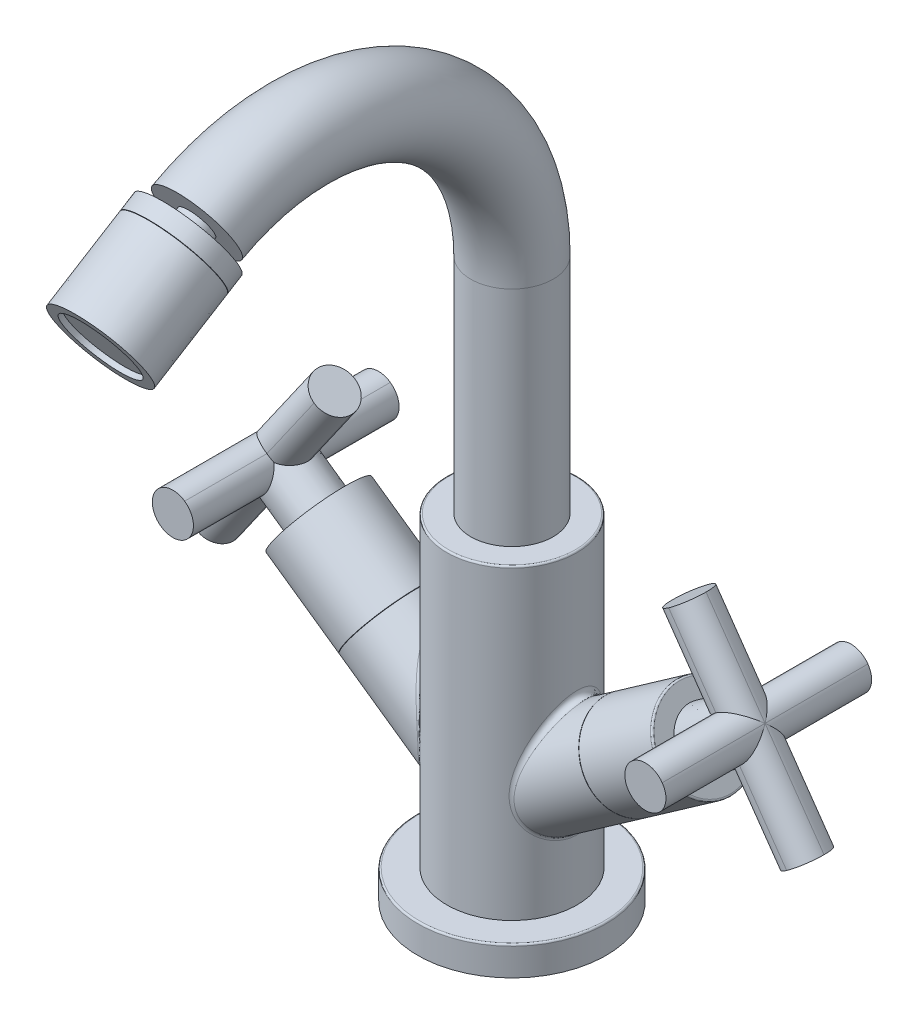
SolidWorks part; units mm, degrees
ref_plane "Front Plane" through (0, 0, 0) normal (0, 0, 1) x (1, 0, 0)
ref_plane "Top Plane" through (0, 0, 0) normal (0, 1, 0) x (1, 0, 0)
ref_plane "Right Plane" through (0, 0, 0) normal (1, 0, 0) x (0, 0, -1)
sketch "Sketch1" plane through (0, 0, 0) normal (0, 0, 1) x (1, 0, 0)
  line L0 (14, 200) -> (14, 213.1353)
  line L1 (-14, 213.1353) -> (-14, 200)
  line L2 (14, 213.1879) -> (14, 215.7624)
  line L3 (-14, 215.7624) -> (-14, 213.1879)
  line L4 (12, 163.0662) -> (12, 193.8645)
  line L5 (12, 221.898) -> (12, 225)
  line L6 (-12, 225) -> (-12, 221.898)
  line L7 (-12, 193.8645) -> (-12, 163.0662)
  line L8 (27.5, 0) -> (27.5, 8.5)
  line L9 (-27.5, 8.5) -> (-27.5, 0)
  line L10 (19, 65.0251) -> (19, 82.9)
  line L11 (19, 8.5) -> (19, 26.0343)
  line L12 (-19, 26.0343) -> (-19, 8.5)
  line L13 (-19, 82.9) -> (-19, 65.0251)
  line L14 (19, 83) -> (19, 98)
  line L15 (-19, 98) -> (-19, 83)
  line L16 (18, 82.9) -> (18, 83)
  line L17 (-18, 83) -> (-18, 82.9)
  line L18 (-42.6502, 43.5615) -> (-19.8331, 27.5848)
  line L19 (-22.1472, 63.3868) -> (-26.5901, 66.4978)
  line L20 (26.5901, 66.4978) -> (22.1472, 63.3868)
  line L21 (19.8331, 27.5848) -> (42.6502, 43.5615)
  line L22 (-64.0301, 58.5319) -> (-42.7321, 43.6189)
  line L23 (-26.672, 66.5551) -> (-47.9699, 81.4681)
  line L24 (47.9699, 81.4681) -> (26.672, 66.5551)
  line L25 (42.7321, 43.6189) -> (64.0301, 58.5319)
  line L26 (-42.1585, 44.438) -> (-42.0766, 44.3807)
  line L27 (-27.1636, 65.6786) -> (-27.2456, 65.736)
  line L28 (27.2456, 65.736) -> (27.1636, 65.6786)
  line L29 (42.0766, 44.3807) -> (42.1585, 44.438)
  line L30 (12, 98) -> (12, 163.0662)
  line L31 (-12, 163.0662) -> (-12, 98)
  line L34 (59.2319, 81.1747) -> (51.8129, 75.9798)
  line L35 (60.1871, 64.0202) -> (67.6062, 69.2151)
  line L36 (67.5327, 69.2207) -> (80.5797, 50.5876)
  line L37 (90.4095, 57.4706) -> (73.2022, 82.0451)
  line L38 (73.2022, 82.0451) -> (55.9949, 106.6197)
  line L39 (46.1651, 99.7368) -> (59.2121, 81.1037)
  line L40 (-67.6062, 69.2151) -> (-60.1871, 64.0202)
  line L41 (-51.8129, 75.9798) -> (-59.2319, 81.1747)
  line L42 (-73.2022, 82.0451) -> (-90.4095, 57.4706)
  line L43 (-80.5797, 50.5876) -> (-67.5327, 69.2207)
  line L44 (-59.2121, 81.1037) -> (-46.1651, 99.7368)
  line L45 (-55.9949, 106.6197) -> (-73.2022, 82.0451)
  line L48 (14, 213.1353) -> (13.9886, 213.615)
  line L49 (13.9886, 213.615) -> (13.7171, 215.518)
  line L50 (13.7171, 215.518) -> (13.0902, 217.3593)
  line L51 (13.0902, 217.3593) -> (12.1244, 219.0913)
  line L52 (12.1244, 219.0913) -> (10.8445, 220.6689)
  line L53 (10.8445, 220.6689) -> (9.2837, 222.0515)
  line L54 (9.2837, 222.0515) -> (7.4825, 223.2031)
  line L55 (7.4825, 223.2031) -> (5.4875, 224.094)
  line L56 (5.4875, 224.094) -> (3.3504, 224.7011)
  line L57 (3.3504, 224.7011) -> (1.1265, 225.0086)
  line L58 (1.1265, 225.0086) -> (-1.1265, 225.0086)
  line L59 (-1.1265, 225.0086) -> (-3.3504, 224.7011)
  line L60 (-3.3504, 224.7011) -> (-5.4875, 224.094)
  line L61 (-5.4875, 224.094) -> (-7.4825, 223.2031)
  line L62 (-7.4825, 223.2031) -> (-9.2837, 222.0515)
  line L63 (-9.2837, 222.0515) -> (-10.8445, 220.6689)
  line L64 (-10.8445, 220.6689) -> (-12.1244, 219.0913)
  line L65 (-12.1244, 219.0913) -> (-13.0902, 217.3593)
  line L66 (-13.0902, 217.3593) -> (-13.7171, 215.518)
  line L67 (-13.7171, 215.518) -> (-13.9886, 213.615)
  line L68 (-13.9886, 213.615) -> (-14, 213.1353)
  line L69 (-2.2458, 188.2424) -> (0, 188.0881)
  line L70 (0, 188.0881) -> (2.2458, 188.2424)
  line L71 (2.2458, 188.2424) -> (4.4334, 188.7012)
  line L72 (4.4334, 188.7012) -> (6.5061, 189.4526)
  line L73 (6.5061, 189.4526) -> (8.4104, 190.4772)
  line L74 (8.4104, 190.4772) -> (10.0968, 191.7484)
  line L75 (10.0968, 191.7484) -> (11.5218, 193.2333)
  line L76 (11.5218, 193.2333) -> (12.6483, 194.8935)
  line L77 (12.6483, 194.8935) -> (13.4473, 196.6859)
  line L78 (13.4473, 196.6859) -> (13.8979, 198.5642)
  line L79 (13.8979, 198.5642) -> (13.9886, 200.4796)
  line L80 (13.9886, 200.4796) -> (13.7171, 202.3827)
  line L81 (13.7171, 202.3827) -> (13.0902, 204.224)
  line L82 (13.0902, 204.224) -> (12.1244, 205.9559)
  line L83 (12.1244, 205.9559) -> (10.8445, 207.5336)
  line L84 (10.8445, 207.5336) -> (9.2837, 208.9162)
  line L85 (9.2837, 208.9162) -> (7.4825, 210.0678)
  line L86 (7.4825, 210.0678) -> (5.4875, 210.9587)
  line L87 (5.4875, 210.9587) -> (3.3504, 211.5657)
  line L88 (3.3504, 211.5657) -> (1.1265, 211.8732)
  line L89 (1.1265, 211.8732) -> (-1.1265, 211.8732)
  line L90 (-1.1265, 211.8732) -> (-3.3504, 211.5657)
  line L91 (-3.3504, 211.5657) -> (-5.4875, 210.9587)
  line L92 (-5.4875, 210.9587) -> (-7.4825, 210.0678)
  line L93 (-7.4825, 210.0678) -> (-9.2837, 208.9162)
  line L94 (-9.2837, 208.9162) -> (-10.8445, 207.5336)
  line L95 (-10.8445, 207.5336) -> (-12.1244, 205.9559)
  line L96 (-12.1244, 205.9559) -> (-13.0902, 204.224)
  line L97 (-13.0902, 204.224) -> (-13.7171, 202.3827)
  line L98 (-13.7171, 202.3827) -> (-13.9886, 200.4796)
  line L99 (-13.9886, 200.4796) -> (-13.8979, 198.5642)
  line L100 (-13.8979, 198.5642) -> (-13.4473, 196.6859)
  line L101 (-13.4473, 196.6859) -> (-12.6483, 194.8935)
  line L102 (-12.6483, 194.8935) -> (-11.5218, 193.2333)
  line L103 (-11.5218, 193.2333) -> (-10.0968, 191.7484)
  line L104 (-10.0968, 191.7484) -> (-8.4104, 190.4772)
  line L105 (-8.4104, 190.4772) -> (-6.5061, 189.4526)
  line L106 (-6.5061, 189.4526) -> (-4.4334, 188.7012)
  line L107 (-4.4334, 188.7012) -> (-2.2458, 188.2424)
  line L108 (1.9641, 190.7911) -> (0, 190.6407)
  line L109 (0, 190.6407) -> (-1.9641, 190.7911)
  line L110 (-1.9641, 190.7911) -> (-3.8651, 191.2375)
  line L111 (-3.8651, 191.2375) -> (-5.6419, 191.9655)
  line L112 (-5.6419, 191.9655) -> (-7.2373, 192.9518)
  line L113 (-7.2373, 192.9518) -> (-8.6001, 194.1646)
  line L114 (-8.6001, 194.1646) -> (-9.6866, 195.5649)
  line L115 (-9.6866, 195.5649) -> (-10.4616, 197.1078)
  line L116 (-10.4616, 197.1078) -> (-10.9004, 198.7437)
  line L117 (-10.9004, 198.7437) -> (-10.9889, 200.4199)
  line L118 (-10.9889, 200.4199) -> (-10.7242, 202.0827)
  line L119 (-10.7242, 202.0827) -> (-10.1148, 203.6785)
  line L120 (-10.1148, 203.6785) -> (-9.1803, 205.156)
  line L121 (-9.1803, 205.156) -> (-7.9507, 206.4679)
  line L122 (-7.9507, 206.4679) -> (-6.4656, 207.5719)
  line L123 (-6.4656, 207.5719) -> (-4.7727, 208.4325)
  line L124 (-4.7727, 208.4325) -> (-2.9264, 209.022)
  line L125 (-2.9264, 209.022) -> (-0.986, 209.3216)
  line L126 (-0.986, 209.3216) -> (0.986, 209.3216)
  line L127 (0.986, 209.3216) -> (2.9264, 209.022)
  line L128 (2.9264, 209.022) -> (4.7727, 208.4325)
  line L129 (4.7727, 208.4325) -> (6.4656, 207.5719)
  line L130 (6.4656, 207.5719) -> (7.9507, 206.4679)
  line L131 (7.9507, 206.4679) -> (9.1803, 205.156)
  line L132 (9.1803, 205.156) -> (10.1148, 203.6785)
  line L133 (10.1148, 203.6785) -> (10.7242, 202.0827)
  line L134 (10.7242, 202.0827) -> (10.9889, 200.4199)
  line L135 (10.9889, 200.4199) -> (10.9004, 198.7437)
  line L136 (10.9004, 198.7437) -> (10.4616, 197.1078)
  line L137 (10.4616, 197.1078) -> (9.6866, 195.5649)
  line L138 (9.6866, 195.5649) -> (8.6001, 194.1646)
  line L139 (8.6001, 194.1646) -> (7.2373, 192.9518)
  line L140 (7.2373, 192.9518) -> (5.6419, 191.9655)
  line L141 (5.6419, 191.9655) -> (3.8651, 191.2375)
  line L142 (3.8651, 191.2375) -> (1.9641, 190.7911)
  line L143 (-1.8925, 192.1707) -> (0, 192.017)
  line L144 (0, 192.017) -> (1.8925, 192.1707)
  line L145 (1.8925, 192.1707) -> (3.7166, 192.6264)
  line L146 (3.7166, 192.6264) -> (5.4064, 193.3676)
  line L147 (5.4064, 193.3676) -> (6.9008, 194.3676)
  line L148 (6.9008, 194.3676) -> (8.1458, 195.59)
  line L149 (8.1458, 195.59) -> (9.0963, 196.9909)
  line L150 (9.0963, 196.9909) -> (9.7181, 198.5195)
  line L151 (9.7181, 198.5195) -> (9.9887, 200.1206)
  line L152 (9.9887, 200.1206) -> (9.8982, 201.7363)
  line L153 (9.8982, 201.7363) -> (9.45, 203.3082)
  line L154 (9.45, 203.3082) -> (8.6603, 204.7796)
  line L155 (8.6603, 204.7796) -> (7.5575, 206.0973)
  line L156 (7.5575, 206.0973) -> (6.1816, 207.2135)
  line L157 (6.1816, 207.2135) -> (4.5823, 208.088)
  line L158 (4.5823, 208.088) -> (2.8173, 208.6892)
  line L159 (2.8173, 208.6892) -> (0.9506, 208.9954)
  line L160 (0.9506, 208.9954) -> (-0.9506, 208.9954)
  line L161 (-0.9506, 208.9954) -> (-2.8173, 208.6892)
  line L162 (-2.8173, 208.6892) -> (-4.5823, 208.088)
  line L163 (-4.5823, 208.088) -> (-6.1816, 207.2135)
  line L164 (-6.1816, 207.2135) -> (-7.5575, 206.0973)
  line L165 (-7.5575, 206.0973) -> (-8.6603, 204.7796)
  line L166 (-8.6603, 204.7796) -> (-9.45, 203.3082)
  line L167 (-9.45, 203.3082) -> (-9.8982, 201.7363)
  line L168 (-9.8982, 201.7363) -> (-9.9887, 200.1206)
  line L169 (-9.9887, 200.1206) -> (-9.7181, 198.5195)
  line L170 (-9.7181, 198.5195) -> (-9.0963, 196.9909)
  line L171 (-9.0963, 196.9909) -> (-8.1458, 195.59)
  line L172 (-8.1458, 195.59) -> (-6.9008, 194.3676)
  line L173 (-6.9008, 194.3676) -> (-5.4064, 193.3676)
  line L174 (-5.4064, 193.3676) -> (-3.7166, 192.6264)
  line L175 (-3.7166, 192.6264) -> (-1.8925, 192.1707)
  line L176 (0, 192.2797) -> (1.8925, 192.4334)
  line L177 (1.8925, 192.4334) -> (3.7166, 192.8891)
  line L178 (3.7166, 192.8891) -> (5.4064, 193.6303)
  line L179 (5.4064, 193.6303) -> (6.9008, 194.6303)
  line L180 (6.9008, 194.6303) -> (8.1458, 195.8527)
  line L181 (8.1458, 195.8527) -> (9.0963, 197.2536)
  line L182 (9.0963, 197.2536) -> (9.7181, 198.7822)
  line L183 (9.7181, 198.7822) -> (9.9887, 200.3833)
  line L184 (9.9887, 200.3833) -> (10, 200.7881)
  line L185 (-10, 200.7881) -> (-9.9887, 200.3833)
  line L186 (-9.9887, 200.3833) -> (-9.7181, 198.7822)
  line L187 (-9.7181, 198.7822) -> (-9.0963, 197.2536)
  line L188 (-9.0963, 197.2536) -> (-8.1458, 195.8527)
  line L189 (-8.1458, 195.8527) -> (-6.9008, 194.6303)
  line L190 (-6.9008, 194.6303) -> (-5.4064, 193.6303)
  line L191 (-5.4064, 193.6303) -> (-3.7166, 192.8891)
  line L192 (-3.7166, 192.8891) -> (-1.8925, 192.4334)
  line L193 (-1.8925, 192.4334) -> (0, 192.2797)
  line L194 (-2.3925, 207.9754) -> (-3.3925, 207.9754)
  line L195 (-3.3925, 207.9754) -> (-3.3925, 207.1246)
  line L196 (-3.3925, 207.1246) -> (-2.3925, 207.1246)
  line L197 (-2.3925, 207.1246) -> (-2.3925, 207.9754)
  line L198 (-1.4284, 205.7214) -> (-2.4284, 205.7214)
  line L199 (-2.4284, 205.7214) -> (-2.4284, 204.8706)
  line L200 (-2.4284, 204.8706) -> (-1.4284, 204.8706)
  line L201 (-1.4284, 204.8706) -> (-1.4284, 205.7214)
  line L202 (-3.3567, 205.1243) -> (-4.3567, 205.1243)
  line L203 (-4.3567, 205.1243) -> (-4.3567, 204.2734)
  line L204 (-4.3567, 204.2734) -> (-3.3567, 204.2734)
  line L205 (-3.3567, 204.2734) -> (-3.3567, 205.1243)
  line L206 (-6.8242, 204.8114) -> (-7.8242, 204.8114)
  line L207 (-7.8242, 204.8114) -> (-7.8242, 203.9606)
  line L208 (-7.8242, 203.9606) -> (-6.8242, 203.9606)
  line L209 (-6.8242, 203.9606) -> (-6.8242, 204.8114)
  line L210 (-4.3828, 203.6121) -> (-5.3828, 203.6121)
  line L211 (-5.3828, 203.6121) -> (-5.3828, 202.7613)
  line L212 (-5.3828, 202.7613) -> (-4.3828, 202.7613)
  line L213 (-4.3828, 202.7613) -> (-4.3828, 203.6121)
  line L214 (-5.4088, 202.1) -> (-6.4088, 202.1)
  line L215 (-6.4088, 202.1) -> (-6.4088, 201.2492)
  line L216 (-6.4088, 201.2492) -> (-5.4088, 201.2492)
  line L217 (-5.4088, 201.2492) -> (-5.4088, 202.1)
  line L218 (-7.8287, 199.964) -> (-8.8287, 199.964)
  line L219 (-8.8287, 199.964) -> (-8.8287, 199.1132)
  line L220 (-8.8287, 199.1132) -> (-7.8287, 199.1132)
  line L221 (-7.8287, 199.1132) -> (-7.8287, 199.964)
  line L222 (-5.0525, 200.3805) -> (-6.0525, 200.3805)
  line L223 (-6.0525, 200.3805) -> (-6.0525, 199.5297)
  line L224 (-6.0525, 199.5297) -> (-5.0525, 199.5297)
  line L225 (-5.0525, 199.5297) -> (-5.0525, 200.3805)
  line L226 (-4.6962, 198.661) -> (-5.6962, 198.661)
  line L227 (-5.6962, 198.661) -> (-5.6962, 197.8102)
  line L228 (-5.6962, 197.8102) -> (-4.6962, 197.8102)
  line L229 (-4.6962, 197.8102) -> (-4.6962, 198.661)
  line L230 (-4.9362, 195.7012) -> (-5.9362, 195.7012)
  line L231 (-5.9362, 195.7012) -> (-5.9362, 194.8504)
  line L232 (-5.9362, 194.8504) -> (-4.9362, 194.8504)
  line L233 (-4.9362, 194.8504) -> (-4.9362, 195.7012)
  line L234 (-3.1241, 197.5387) -> (-4.1241, 197.5387)
  line L235 (-4.1241, 197.5387) -> (-4.1241, 196.6878)
  line L236 (-4.1241, 196.6878) -> (-3.1241, 196.6878)
  line L237 (-3.1241, 196.6878) -> (-3.1241, 197.5387)
  line L238 (-1.5521, 196.4163) -> (-2.5521, 196.4163)
  line L239 (-2.5521, 196.4163) -> (-2.5521, 195.5655)
  line L240 (-2.5521, 195.5655) -> (-1.5521, 195.5655)
  line L241 (-1.5521, 195.5655) -> (-1.5521, 196.4163)
  line L242 (0.5, 194.0177) -> (-0.5, 194.0177)
  line L243 (-0.5, 194.0177) -> (-0.5, 193.1669)
  line L244 (-0.5, 193.1669) -> (0.5, 193.1669)
  line L245 (0.5, 193.1669) -> (0.5, 194.0177)
  line L246 (0.5, 196.4163) -> (-0.5, 196.4163)
  line L247 (-0.5, 196.4163) -> (-0.5, 195.5655)
  line L248 (-0.5, 195.5655) -> (0.5, 195.5655)
  line L249 (0.5, 195.5655) -> (0.5, 196.4163)
  line L250 (2.5521, 196.4163) -> (1.5521, 196.4163)
  line L251 (1.5521, 196.4163) -> (1.5521, 195.5655)
  line L252 (1.5521, 195.5655) -> (2.5521, 195.5655)
  line L253 (2.5521, 195.5655) -> (2.5521, 196.4163)
  line L254 (-1.4284, 203.1689) -> (-2.4284, 203.1689)
  line L255 (-2.4284, 203.1689) -> (-2.4284, 202.3181)
  line L256 (-2.4284, 202.3181) -> (-1.4284, 202.3181)
  line L257 (-1.4284, 202.3181) -> (-1.4284, 203.1689)
  line L258 (5.9362, 195.7012) -> (4.9362, 195.7012)
  line L259 (4.9362, 195.7012) -> (4.9362, 194.8504)
  line L260 (4.9362, 194.8504) -> (5.9362, 194.8504)
  line L261 (5.9362, 194.8504) -> (5.9362, 195.7012)
  line L262 (4.1241, 197.5387) -> (3.1241, 197.5387)
  line L263 (3.1241, 197.5387) -> (3.1241, 196.6878)
  line L264 (3.1241, 196.6878) -> (4.1241, 196.6878)
  line L265 (4.1241, 196.6878) -> (4.1241, 197.5387)
  line L266 (-2.4544, 201.6568) -> (-3.4544, 201.6568)
  line L267 (-3.4544, 201.6568) -> (-3.4544, 200.806)
  line L268 (-3.4544, 200.806) -> (-2.4544, 200.806)
  line L269 (-2.4544, 200.806) -> (-2.4544, 201.6568)
  line L270 (5.6962, 198.661) -> (4.6962, 198.661)
  line L271 (4.6962, 198.661) -> (4.6962, 197.8102)
  line L272 (4.6962, 197.8102) -> (5.6962, 197.8102)
  line L273 (5.6962, 197.8102) -> (5.6962, 198.661)
  line L274 (-2.0981, 199.9373) -> (-3.0981, 199.9373)
  line L275 (-3.0981, 199.9373) -> (-3.0981, 199.0864)
  line L276 (-3.0981, 199.0864) -> (-2.0981, 199.0864)
  line L277 (-2.0981, 199.0864) -> (-2.0981, 199.9373)
  line L278 (8.8287, 199.964) -> (7.8287, 199.964)
  line L279 (7.8287, 199.964) -> (7.8287, 199.1132)
  line L280 (7.8287, 199.1132) -> (8.8287, 199.1132)
  line L281 (8.8287, 199.1132) -> (8.8287, 199.964)
  line L282 (6.0525, 200.3805) -> (5.0525, 200.3805)
  line L283 (5.0525, 200.3805) -> (5.0525, 199.5297)
  line L284 (5.0525, 199.5297) -> (6.0525, 199.5297)
  line L285 (6.0525, 199.5297) -> (6.0525, 200.3805)
  line L286 (-0.5261, 198.815) -> (-1.5261, 198.815)
  line L287 (-1.5261, 198.815) -> (-1.5261, 197.9641)
  line L288 (-1.5261, 197.9641) -> (-0.5261, 197.9641)
  line L289 (-0.5261, 197.9641) -> (-0.5261, 198.815)
  line L290 (6.4088, 202.1) -> (5.4088, 202.1)
  line L291 (5.4088, 202.1) -> (5.4088, 201.2492)
  line L292 (5.4088, 201.2492) -> (6.4088, 201.2492)
  line L293 (6.4088, 201.2492) -> (6.4088, 202.1)
  line L294 (1.5261, 198.815) -> (0.5261, 198.815)
  line L295 (0.5261, 198.815) -> (0.5261, 197.9641)
  line L296 (0.5261, 197.9641) -> (1.5261, 197.9641)
  line L297 (1.5261, 197.9641) -> (1.5261, 198.815)
  line L298 (7.8242, 204.8114) -> (6.8242, 204.8114)
  line L299 (6.8242, 204.8114) -> (6.8242, 203.9606)
  line L300 (6.8242, 203.9606) -> (7.8242, 203.9606)
  line L301 (7.8242, 203.9606) -> (7.8242, 204.8114)
  line L302 (5.3828, 203.6121) -> (4.3828, 203.6121)
  line L303 (4.3828, 203.6121) -> (4.3828, 202.7613)
  line L304 (4.3828, 202.7613) -> (5.3828, 202.7613)
  line L305 (5.3828, 202.7613) -> (5.3828, 203.6121)
  line L306 (3.0981, 199.9373) -> (2.0981, 199.9373)
  line L307 (2.0981, 199.9373) -> (2.0981, 199.0864)
  line L308 (2.0981, 199.0864) -> (3.0981, 199.0864)
  line L309 (3.0981, 199.0864) -> (3.0981, 199.9373)
  line L310 (4.3567, 205.1243) -> (3.3567, 205.1243)
  line L311 (3.3567, 205.1243) -> (3.3567, 204.2734)
  line L312 (3.3567, 204.2734) -> (4.3567, 204.2734)
  line L313 (4.3567, 204.2734) -> (4.3567, 205.1243)
  line L314 (3.4544, 201.6568) -> (2.4544, 201.6568)
  line L315 (2.4544, 201.6568) -> (2.4544, 200.806)
  line L316 (2.4544, 200.806) -> (3.4544, 200.806)
  line L317 (3.4544, 200.806) -> (3.4544, 201.6568)
  line L318 (3.3925, 207.9754) -> (2.3925, 207.9754)
  line L319 (2.3925, 207.9754) -> (2.3925, 207.1246)
  line L320 (2.3925, 207.1246) -> (3.3925, 207.1246)
  line L321 (3.3925, 207.1246) -> (3.3925, 207.9754)
  line L322 (2.4284, 205.7214) -> (1.4284, 205.7214)
  line L323 (1.4284, 205.7214) -> (1.4284, 204.8706)
  line L324 (1.4284, 204.8706) -> (2.4284, 204.8706)
  line L325 (2.4284, 204.8706) -> (2.4284, 205.7214)
  line L326 (2.4284, 203.1689) -> (1.4284, 203.1689)
  line L327 (1.4284, 203.1689) -> (1.4284, 202.3181)
  line L328 (1.4284, 202.3181) -> (2.4284, 202.3181)
  line L329 (2.4284, 202.3181) -> (2.4284, 203.1689)
  line L330 (0.5, 206.3186) -> (-0.5, 206.3186)
  line L331 (-0.5, 206.3186) -> (-0.5, 205.4678)
  line L332 (-0.5, 205.4678) -> (0.5, 205.4678)
  line L333 (0.5, 205.4678) -> (0.5, 206.3186)
  line L334 (0.5, 201.2135) -> (-0.5, 201.2135)
  line L335 (-0.5, 201.2135) -> (-0.5, 200.3627)
  line L336 (-0.5, 200.3627) -> (0.5, 200.3627)
  line L337 (0.5, 200.3627) -> (0.5, 201.2135)
  line L338 (0.5, 203.7661) -> (-0.5, 203.7661)
  line L339 (-0.5, 203.7661) -> (-0.5, 202.9152)
  line L340 (-0.5, 202.9152) -> (0.5, 202.9152)
  line L341 (0.5, 202.9152) -> (0.5, 203.7661)
  line L342 (14, 213.1879) -> (13.9886, 213.6675)
  line L343 (13.9886, 213.6675) -> (13.7171, 215.5706)
  line L344 (13.7171, 215.5706) -> (13.0902, 217.4119)
  line L345 (13.0902, 217.4119) -> (12.1244, 219.1438)
  line L346 (12.1244, 219.1438) -> (10.8445, 220.7215)
  line L347 (10.8445, 220.7215) -> (9.2837, 222.104)
  line L348 (9.2837, 222.104) -> (7.4825, 223.2557)
  line L349 (7.4825, 223.2557) -> (5.4875, 224.1465)
  line L350 (5.4875, 224.1465) -> (3.3504, 224.7536)
  line L351 (3.3504, 224.7536) -> (1.1265, 225.0611)
  line L352 (1.1265, 225.0611) -> (-1.1265, 225.0611)
  line L353 (-1.1265, 225.0611) -> (-3.3504, 224.7536)
  line L354 (-3.3504, 224.7536) -> (-5.4875, 224.1465)
  line L355 (-5.4875, 224.1465) -> (-7.4825, 223.2557)
  line L356 (-7.4825, 223.2557) -> (-9.2837, 222.104)
  line L357 (-9.2837, 222.104) -> (-10.8445, 220.7215)
  line L358 (-10.8445, 220.7215) -> (-12.1244, 219.1438)
  line L359 (-12.1244, 219.1438) -> (-13.0902, 217.4119)
  line L360 (-13.0902, 217.4119) -> (-13.7171, 215.5706)
  line L361 (-13.7171, 215.5706) -> (-13.9886, 213.6675)
  line L362 (-13.9886, 213.6675) -> (-14, 213.1879)
  line L363 (14, 215.7624) -> (13.9886, 216.242)
  line L364 (13.9886, 216.242) -> (13.7171, 218.1451)
  line L365 (13.7171, 218.1451) -> (13.0902, 219.9864)
  line L366 (13.0902, 219.9864) -> (12.1244, 221.7183)
  line L367 (12.1244, 221.7183) -> (10.8445, 223.296)
  line L368 (10.8445, 223.296) -> (9.2837, 224.6786)
  line L369 (9.2837, 224.6786) -> (7.4825, 225.8302)
  line L370 (7.4825, 225.8302) -> (5.4875, 226.7211)
  line L371 (5.4875, 226.7211) -> (3.3504, 227.3281)
  line L372 (3.3504, 227.3281) -> (1.1265, 227.6356)
  line L373 (1.1265, 227.6356) -> (-1.1265, 227.6356)
  line L374 (-1.1265, 227.6356) -> (-3.3504, 227.3281)
  line L375 (-3.3504, 227.3281) -> (-5.4875, 226.7211)
  line L376 (-5.4875, 226.7211) -> (-7.4825, 225.8302)
  line L377 (-7.4825, 225.8302) -> (-9.2837, 224.6786)
  line L378 (-9.2837, 224.6786) -> (-10.8445, 223.296)
  line L379 (-10.8445, 223.296) -> (-12.1244, 221.7183)
  line L380 (-12.1244, 221.7183) -> (-13.0902, 219.9864)
  line L381 (-13.0902, 219.9864) -> (-13.7171, 218.1451)
  line L382 (-13.7171, 218.1451) -> (-13.9886, 216.242)
  line L383 (-13.9886, 216.242) -> (-14, 215.7624)
  line L384 (27.5, 0) -> (-27.5, 0)
  line L385 (27.5, 8.5) -> (-27.5, 8.5)
  line L386 (18.9131, 26.0477) -> (18.9265, 26.0343)
  line L387 (-18.9132, 26.0477) -> (-18.9265, 26.0343)
  line L388 (19, 82.9) -> (-19, 82.9)
  line L389 (19, 83) -> (-19, 83)
  line L390 (19, 98) -> (-19, 98)
  line L391 (-26.5901, 66.4978) -> (-26.694, 66.3493)
  line L392 (-26.694, 66.3493) -> (-27.0033, 65.9076)
  line L393 (-27.0033, 65.9076) -> (-27.5099, 65.1842)
  line L394 (-27.5099, 65.1842) -> (-28.2006, 64.1978)
  line L395 (-28.2006, 64.1978) -> (-29.0575, 62.9739)
  line L396 (-29.0575, 62.9739) -> (-30.0585, 61.5443)
  line L397 (-30.0585, 61.5443) -> (-31.1777, 59.946)
  line L398 (-31.1777, 59.946) -> (-32.386, 58.2203)
  line L399 (-32.386, 58.2203) -> (-33.6522, 56.412)
  line L400 (-33.6522, 56.412) -> (-34.9435, 54.5679)
  line L401 (-34.9435, 54.5679) -> (-36.2264, 52.7357)
  line L402 (-36.2264, 52.7357) -> (-37.4676, 50.963)
  line L403 (-37.4676, 50.963) -> (-38.6352, 49.2956)
  line L404 (-38.6352, 49.2956) -> (-39.6987, 47.7767)
  line L405 (-39.6987, 47.7767) -> (-40.6307, 46.4456)
  line L406 (-40.6307, 46.4456) -> (-41.4071, 45.3369)
  line L407 (-41.4071, 45.3369) -> (-42.0076, 44.4792)
  line L408 (-42.0076, 44.4792) -> (-42.4169, 43.8948)
  line L409 (-42.4169, 43.8948) -> (-42.6242, 43.5987)
  line L410 (-42.6242, 43.5987) -> (-42.6502, 43.5615)
  line L411 (26.5901, 66.4978) -> (26.694, 66.3493)
  line L412 (26.694, 66.3493) -> (27.0033, 65.9076)
  line L413 (27.0033, 65.9076) -> (27.5099, 65.1842)
  line L414 (27.5099, 65.1842) -> (28.2006, 64.1978)
  line L415 (28.2006, 64.1978) -> (29.0575, 62.9739)
  line L416 (29.0575, 62.9739) -> (30.0585, 61.5443)
  line L417 (30.0585, 61.5443) -> (31.1777, 59.946)
  line L418 (31.1777, 59.946) -> (32.386, 58.2203)
  line L419 (32.386, 58.2203) -> (33.6522, 56.412)
  line L420 (33.6522, 56.412) -> (34.9435, 54.5679)
  line L421 (34.9435, 54.5679) -> (36.2264, 52.7357)
  line L422 (36.2264, 52.7357) -> (37.4676, 50.963)
  line L423 (37.4676, 50.963) -> (38.6352, 49.2956)
  line L424 (38.6352, 49.2956) -> (39.6987, 47.7767)
  line L425 (39.6987, 47.7767) -> (40.6307, 46.4456)
  line L426 (40.6307, 46.4456) -> (41.4071, 45.3369)
  line L427 (41.4071, 45.3369) -> (42.0076, 44.4792)
  line L428 (42.0076, 44.4792) -> (42.4169, 43.8948)
  line L429 (42.4169, 43.8948) -> (42.6242, 43.5987)
  line L430 (42.6242, 43.5987) -> (42.6502, 43.5615)
  line L431 (-26.672, 66.5551) -> (-26.776, 66.4066)
  line L432 (-26.776, 66.4066) -> (-27.0852, 65.965)
  line L433 (-27.0852, 65.965) -> (-27.5918, 65.2415)
  line L434 (-27.5918, 65.2415) -> (-28.2825, 64.2551)
  line L435 (-28.2825, 64.2551) -> (-29.1394, 63.0313)
  line L436 (-29.1394, 63.0313) -> (-30.1404, 61.6017)
  line L437 (-30.1404, 61.6017) -> (-31.2596, 60.0033)
  line L438 (-31.2596, 60.0033) -> (-32.4679, 58.2776)
  line L439 (-32.4679, 58.2776) -> (-33.7341, 56.4693)
  line L440 (-33.7341, 56.4693) -> (-35.0254, 54.6252)
  line L441 (-35.0254, 54.6252) -> (-36.3083, 52.7931)
  line L442 (-36.3083, 52.7931) -> (-37.5495, 51.0204)
  line L443 (-37.5495, 51.0204) -> (-38.7171, 49.353)
  line L444 (-38.7171, 49.353) -> (-39.7806, 47.834)
  line L445 (-39.7806, 47.834) -> (-40.7126, 46.503)
  line L446 (-40.7126, 46.503) -> (-41.489, 45.3943)
  line L447 (-41.489, 45.3943) -> (-42.0895, 44.5366)
  line L448 (-42.0895, 44.5366) -> (-42.4988, 43.9521)
  line L449 (-42.4988, 43.9521) -> (-42.7061, 43.6561)
  line L450 (-42.7061, 43.6561) -> (-42.7321, 43.6189)
  line L451 (-47.9699, 81.4681) -> (-48.0739, 81.3196)
  line L452 (-48.0739, 81.3196) -> (-48.3832, 80.8779)
  line L453 (-48.3832, 80.8779) -> (-48.8897, 80.1545)
  line L454 (-48.8897, 80.1545) -> (-49.5804, 79.1681)
  line L455 (-49.5804, 79.1681) -> (-50.4374, 77.9443)
  line L456 (-50.4374, 77.9443) -> (-51.4384, 76.5146)
  line L457 (-51.4384, 76.5146) -> (-52.5576, 74.9163)
  line L458 (-52.5576, 74.9163) -> (-53.7659, 73.1906)
  line L459 (-53.7659, 73.1906) -> (-55.0321, 71.3823)
  line L460 (-55.0321, 71.3823) -> (-56.3233, 69.5382)
  line L461 (-56.3233, 69.5382) -> (-57.6062, 67.7061)
  line L462 (-57.6062, 67.7061) -> (-58.8475, 65.9334)
  line L463 (-58.8475, 65.9334) -> (-60.015, 64.2659)
  line L464 (-60.015, 64.2659) -> (-61.0786, 62.747)
  line L465 (-61.0786, 62.747) -> (-62.0106, 61.416)
  line L466 (-62.0106, 61.416) -> (-62.7869, 60.3073)
  line L467 (-62.7869, 60.3073) -> (-63.3875, 59.4496)
  line L468 (-63.3875, 59.4496) -> (-63.7967, 58.8651)
  line L469 (-63.7967, 58.8651) -> (-64.004, 58.5691)
  line L470 (-64.004, 58.5691) -> (-64.0301, 58.5319)
  line L471 (26.672, 66.5551) -> (26.776, 66.4066)
  line L472 (26.776, 66.4066) -> (27.0852, 65.965)
  line L473 (27.0852, 65.965) -> (27.5918, 65.2415)
  line L474 (27.5918, 65.2415) -> (28.2825, 64.2551)
  line L475 (28.2825, 64.2551) -> (29.1394, 63.0313)
  line L476 (29.1394, 63.0313) -> (30.1404, 61.6017)
  line L477 (30.1404, 61.6017) -> (31.2596, 60.0033)
  line L478 (31.2596, 60.0033) -> (32.4679, 58.2776)
  line L479 (32.4679, 58.2776) -> (33.7341, 56.4693)
  line L480 (33.7341, 56.4693) -> (35.0254, 54.6252)
  line L481 (35.0254, 54.6252) -> (36.3083, 52.7931)
  line L482 (36.3083, 52.7931) -> (37.5495, 51.0204)
  line L483 (37.5495, 51.0204) -> (38.7171, 49.353)
  line L484 (38.7171, 49.353) -> (39.7806, 47.834)
  line L485 (39.7806, 47.834) -> (40.7126, 46.503)
  line L486 (40.7126, 46.503) -> (41.489, 45.3943)
  line L487 (41.489, 45.3943) -> (42.0895, 44.5366)
  line L488 (42.0895, 44.5366) -> (42.4988, 43.9521)
  line L489 (42.4988, 43.9521) -> (42.7061, 43.6561)
  line L490 (42.7061, 43.6561) -> (42.7321, 43.6189)
  line L491 (47.9699, 81.4681) -> (48.0739, 81.3196)
  line L492 (48.0739, 81.3196) -> (48.3832, 80.8779)
  line L493 (48.3832, 80.8779) -> (48.8897, 80.1545)
  line L494 (48.8897, 80.1545) -> (49.5804, 79.1681)
  line L495 (49.5804, 79.1681) -> (50.4374, 77.9443)
  line L496 (50.4374, 77.9443) -> (51.4384, 76.5146)
  line L497 (51.4384, 76.5146) -> (52.5576, 74.9163)
  line L498 (52.5576, 74.9163) -> (53.7659, 73.1906)
  line L499 (53.7659, 73.1906) -> (55.0321, 71.3823)
  line L500 (55.0321, 71.3823) -> (56.3233, 69.5382)
  line L501 (56.3233, 69.5382) -> (57.6062, 67.7061)
  line L502 (57.6062, 67.7061) -> (58.8475, 65.9334)
  line L503 (58.8475, 65.9334) -> (60.015, 64.2659)
  line L504 (60.015, 64.2659) -> (61.0786, 62.747)
  line L505 (61.0786, 62.747) -> (62.0106, 61.416)
  line L506 (62.0106, 61.416) -> (62.7869, 60.3073)
  line L507 (62.7869, 60.3073) -> (63.3875, 59.4496)
  line L508 (63.3875, 59.4496) -> (63.7967, 58.8651)
  line L509 (63.7967, 58.8651) -> (64.004, 58.5691)
  line L510 (64.004, 58.5691) -> (64.0301, 58.5319)
  line L515 (90.4095, 57.4706) -> (90.3707, 57.4434)
  line L516 (90.3707, 57.4434) -> (90.0643, 57.2289)
  line L517 (90.0643, 57.2289) -> (89.4708, 56.8133)
  line L518 (89.4708, 56.8133) -> (88.6275, 56.2228)
  line L519 (88.6275, 56.2228) -> (87.5872, 55.4944)
  line L520 (87.5872, 55.4944) -> (86.4155, 54.6739)
  line L521 (86.4155, 54.6739) -> (85.186, 53.813)
  line L522 (85.186, 53.813) -> (83.9758, 52.9656)
  line L523 (83.9758, 52.9656) -> (82.861, 52.1851)
  line L524 (82.861, 52.1851) -> (81.9118, 51.5204)
  line L525 (81.9118, 51.5204) -> (81.1876, 51.0133)
  line L526 (81.1876, 51.0133) -> (80.7341, 50.6958)
  line L527 (80.7341, 50.6958) -> (80.5797, 50.5876)
  line L528 (46.1651, 99.7368) -> (46.3195, 99.8449)
  line L529 (46.3195, 99.8449) -> (46.773, 100.1624)
  line L530 (46.773, 100.1624) -> (47.4972, 100.6695)
  line L531 (47.4972, 100.6695) -> (48.4464, 101.3342)
  line L532 (48.4464, 101.3342) -> (49.5612, 102.1147)
  line L533 (49.5612, 102.1147) -> (50.7714, 102.9621)
  line L534 (50.7714, 102.9621) -> (52.001, 103.8231)
  line L535 (52.001, 103.8231) -> (53.1727, 104.6435)
  line L536 (53.1727, 104.6435) -> (54.2129, 105.3719)
  line L537 (54.2129, 105.3719) -> (55.0562, 105.9624)
  line L538 (55.0562, 105.9624) -> (55.6498, 106.378)
  line L539 (55.6498, 106.378) -> (55.9561, 106.5925)
  line L540 (55.9561, 106.5925) -> (55.9949, 106.6197)
  line L541 (-80.5797, 50.5876) -> (-80.7341, 50.6958)
  line L542 (-80.7341, 50.6958) -> (-81.1876, 51.0133)
  line L543 (-81.1876, 51.0133) -> (-81.9118, 51.5204)
  line L544 (-81.9118, 51.5204) -> (-82.861, 52.1851)
  line L545 (-82.861, 52.1851) -> (-83.9758, 52.9656)
  line L546 (-83.9758, 52.9656) -> (-85.186, 53.813)
  line L547 (-85.186, 53.813) -> (-86.4155, 54.6739)
  line L548 (-86.4155, 54.6739) -> (-87.5872, 55.4944)
  line L549 (-87.5872, 55.4944) -> (-88.6275, 56.2228)
  line L550 (-88.6275, 56.2228) -> (-89.4708, 56.8133)
  line L551 (-89.4708, 56.8133) -> (-90.0643, 57.2289)
  line L552 (-90.0643, 57.2289) -> (-90.3707, 57.4434)
  line L553 (-90.3707, 57.4434) -> (-90.4095, 57.4706)
  line L554 (-55.9949, 106.6197) -> (-55.9561, 106.5925)
  line L555 (-55.9561, 106.5925) -> (-55.6498, 106.378)
  line L556 (-55.6498, 106.378) -> (-55.0562, 105.9624)
  line L557 (-55.0562, 105.9624) -> (-54.2129, 105.3719)
  line L558 (-54.2129, 105.3719) -> (-53.1727, 104.6435)
  line L559 (-53.1727, 104.6435) -> (-52.001, 103.8231)
  line L560 (-52.001, 103.8231) -> (-50.7714, 102.9621)
  line L561 (-50.7714, 102.9621) -> (-49.5612, 102.1147)
  line L562 (-49.5612, 102.1147) -> (-48.4464, 101.3342)
  line L563 (-48.4464, 101.3342) -> (-47.4972, 100.6695)
  line L564 (-47.4972, 100.6695) -> (-46.773, 100.1624)
  line L565 (-46.773, 100.1624) -> (-46.3195, 99.8449)
  line L566 (-46.3195, 99.8449) -> (-46.1651, 99.7368)
  line L567 (-27.5, 0) -> (27.5, 0)
  line L574 (0, 0) -> (0, 237) construction
  line L575 (-73.2022, 82.0451) -> (0, 30.7884) construction
  line L576 (0, 30.1002) -> (73.5038, 81.5681) construction
  arc A0 (12, 225) -> (-12, 225) centre (0, 225) ccw
  circle A1 centre (68.2873, 78.6037) radius 6
  circle A2 centre (-68.2873, 78.6036) radius 6
  spline S0 degree 3 poles (-19.0066, 65.0118) (-19.0023, 64.9669) (-18.9754, 64.6858) (-19.1461, 64.1481) (-19.5697, 63.5331) (-20.213, 63.1179) (-20.8968, 62.9727) (-21.5009, 63.0532) (-21.9156, 63.2121) (-22.1096, 63.3591) (-22.1742, 63.408) knots 0 0 0 0 0.030683 0.192348 0.368782 0.533189 0.701933 0.834283 0.944803 1 1 1 1
  spline S1 degree 3 poles (-19.8505, 27.5666) (-19.7311, 27.4864) (-19.3966, 27.2619) (-19.1126, 26.7135) (-18.9764, 26.2608) (-18.9914, 26.058) (-18.9917, 26.0538) knots 0 0 0 0 0.236552 0.662253 0.993 1 1 1 1
  spline S2 degree 3 poles (18.9912, 26.0324) (19.021, 26.2511) (19.0834, 26.7088) (19.4049, 27.2622) (19.7283, 27.482) (19.8518, 27.5659) knots 0 0 0 0 0.361449 0.756313 1 1 1 1
  spline S3 degree 3 poles (22.1634, 63.4054) (22.108, 63.3611) (21.8779, 63.1771) (21.3625, 63.0094) (20.6591, 62.9923) (19.9807, 63.2345) (19.4661, 63.665) (19.1606, 64.1558) (19.0137, 64.6048) (18.9999, 64.8867) (18.9937, 65.0126) knots 0 0 0 0 0.04838 0.200902 0.358443 0.523192 0.681258 0.807671 0.914101 1 1 1 1
  spline S4 degree 3 poles (59.2588, 81.1364) (59.2674, 81.1357) (59.4613, 81.1211) (60.0023, 81.0836) (61.0862, 81.0311) (62.0819, 81.0269) (62.7267, 81.0712) (62.8211, 81.0777) knots 0 0 0 0 0.007268 0.163613 0.456283 0.920362 1 1 1 1
  spline S5 degree 3 poles (68.7426, 72.621) (68.4929, 71.9852) (68.2433, 71.3494) (68.084, 70.9103) knots 0 0 0 0 0.508691 0.508691 0.508691 0.508691
  spline S6 degree 3 poles (68.084, 70.9103) (67.9778, 70.6174) (67.9117, 70.4121) (67.7198, 69.7436) knots 0.508691 0.508691 0.508691 0.508691 0.847859 0.847859 0.847859 0.847859
  spline S7 degree 3 poles (67.7198, 69.7436) (67.6368, 69.4542) (67.5301, 69.078) (67.5742, 69.2349) knots 0.847859 0.847859 0.847859 0.847859 0.994683 0.994683 0.994683 0.994683
  spline S8 degree 3 poles (67.5742, 69.2349) (67.5758, 69.2406) (67.5775, 69.247) (67.5793, 69.2534) knots 0.994683 0.994683 0.994683 0.994683 1 1 1 1
  spline S9 degree 3 poles (-62.8211, 81.0777) (-62.1383, 81.0605) (-61.4555, 81.0434) (-60.9883, 81.0439) knots 0 0 0 0 0.508693 0.508693 0.508693 0.508693
  spline S10 degree 3 poles (-60.9883, 81.0439) (-60.6768, 81.0442) (-60.4612, 81.0524) (-59.7674, 81.1008) knots 0.508693 0.508693 0.508693 0.508693 0.847859 0.847859 0.847859 0.847859
  spline S11 degree 3 poles (-59.7674, 81.1008) (-59.4671, 81.1217) (-59.0771, 81.1501) (-59.2397, 81.1378) knots 0.847859 0.847859 0.847859 0.847859 0.994683 0.994683 0.994683 0.994683
  spline S12 degree 3 poles (-59.2397, 81.1378) (-59.2455, 81.1374) (-59.2521, 81.1369) (-59.2588, 81.1364) knots 0.994683 0.994683 0.994683 0.994683 1 1 1 1
  spline S13 degree 3 poles (-67.5793, 69.2534) (-67.5817, 69.2617) (-67.6342, 69.4489) (-67.784, 69.9701) (-68.1054, 71.0066) (-68.442, 71.9437) (-68.7042, 72.5344) (-68.7426, 72.621) knots 0 0 0 0 0.007271 0.163615 0.456284 0.920362 1 1 1 1
sketch "Sketch2" plane through (0, 0, 0) normal (1, 0, 0) x (0, 0, -1)
  line L0 (14, 70) -> (14, 55.087)
  line L1 (-14, 55.087) -> (-14, 70)
  line L2 (14, 55.0297) -> (14, 40.3403)
  line L3 (-14, 40.3302) -> (-14, 55.0297)
  line L4 (-27.5, 0) -> (-27.5, 8.5)
  line L5 (27.5, 8.5) -> (27.5, 0)
  line L6 (-19, 8.5) -> (-19, 72.6037)
  line L7 (19, 28.2456) -> (19, 8.5)
  line L8 (19, 72.6037) -> (19, 46.4836)
  line L9 (-19, 84.6036) -> (-19, 98)
  line L10 (19, 98) -> (19, 84.6036)
  line L11 (-105.9995, 225.0997) -> (-101.8304, 227.6743)
  line L12 (-87.1188, 203.8505) -> (-91.2879, 201.276)
  line L13 (-127.3558, 211.9118) -> (-106.0846, 225.0472)
  line L14 (-91.373, 201.2235) -> (-112.6442, 188.0881)
  line L15 (-91.2879, 201.276) -> (-105.9995, 225.0997)
  line L16 (-91.373, 201.2235) -> (-106.0846, 225.0472)
  line L17 (-12, 98) -> (-12, 163.0662)
  line L18 (12, 163.0662) -> (12, 98)
  line L19 (-97.1017, 220.0167) -> (-94.5491, 221.5929)
  line L20 (-89.295, 213.0844) -> (-91.8475, 211.5082)
  line L21 (-85.5718, 207.0506) -> (-98.1917, 227.4988)
  line L22 (-87.1188, 203.8505) -> (-101.8304, 227.6743)
  line L23 (23.1276, 38.7662) -> (18.9578, 28.9428)
  line L24 (6, 73.6887) -> (6, 54.0291)
  line L25 (-6, 54.0291) -> (-6, 73.6887)
  line L26 (4.9149, 84.6036) -> (30, 84.6036)
  line L27 (30, 72.6037) -> (6, 72.6037)
  line L28 (-30, 84.6036) -> (-4.9149, 84.6036)
  line L29 (-6, 72.6037) -> (-30, 72.6037)
  line L30 (-6, 84.6036) -> (-6, 103.1782)
  line L31 (6, 103.1782) -> (6, 84.6036)
  line L32 (7.3, 72.6037) -> (7.3, 70)
  line L33 (-7.3, 70) -> (-7.3, 72.6037)
  line L34 (27.4998, 0) -> (27.5, 0)
  line L35 (-27.5, 0) -> (-27.4998, 0)
  line L36 (-13.6344, 72.6037) -> (-13.8979, 71.3823)
  line L37 (-13.8979, 71.3823) -> (-13.9886, 69.5382)
  line L38 (-13.9886, 69.5382) -> (-13.7171, 67.7061)
  line L39 (-13.7171, 67.7061) -> (-13.0902, 65.9334)
  line L40 (-13.0902, 65.9334) -> (-12.1244, 64.2659)
  line L41 (-12.1244, 64.2659) -> (-10.8445, 62.747)
  line L42 (-10.8445, 62.747) -> (-9.2837, 61.416)
  line L43 (-9.2837, 61.416) -> (-7.4825, 60.3073)
  line L44 (-7.4825, 60.3073) -> (-6, 59.6385)
  line L45 (6, 59.6385) -> (7.4825, 60.3073)
  line L46 (7.4825, 60.3073) -> (9.2837, 61.416)
  line L47 (9.2837, 61.416) -> (10.8445, 62.747)
  line L48 (10.8445, 62.747) -> (12.1244, 64.2659)
  line L49 (12.1244, 64.2659) -> (13.0902, 65.9334)
  line L50 (13.0902, 65.9334) -> (13.7171, 67.7061)
  line L51 (13.7171, 67.7061) -> (13.9886, 69.5382)
  line L52 (13.9886, 69.5382) -> (13.8979, 71.3823)
  line L53 (13.8979, 71.3823) -> (13.6344, 72.6037)
  line L54 (-14, 55.087) -> (-13.9886, 54.6252)
  line L55 (-13.9886, 54.6252) -> (-13.7171, 52.7931)
  line L56 (-13.7171, 52.7931) -> (-13.0902, 51.0204)
  line L57 (-13.0902, 51.0204) -> (-12.1244, 49.353)
  line L58 (-12.1244, 49.353) -> (-10.8445, 47.834)
  line L59 (-10.8445, 47.834) -> (-9.2837, 46.503)
  line L60 (-9.2837, 46.503) -> (-7.4825, 45.3943)
  line L61 (-7.4825, 45.3943) -> (-5.4875, 44.5366)
  line L62 (-5.4875, 44.5366) -> (-3.3504, 43.9521)
  line L63 (-3.3504, 43.9521) -> (-1.1265, 43.6561)
  line L64 (-1.1265, 43.6561) -> (1.1265, 43.6561)
  line L65 (1.1265, 43.6561) -> (3.3504, 43.9521)
  line L66 (3.3504, 43.9521) -> (5.4875, 44.5366)
  line L67 (5.4875, 44.5366) -> (7.4825, 45.3943)
  line L68 (7.4825, 45.3943) -> (9.2837, 46.503)
  line L69 (9.2837, 46.503) -> (10.8445, 47.834)
  line L70 (10.8445, 47.834) -> (12.1244, 49.353)
  line L71 (12.1244, 49.353) -> (13.0902, 51.0204)
  line L72 (13.0902, 51.0204) -> (13.7171, 52.7931)
  line L73 (13.7171, 52.7931) -> (13.9886, 54.6252)
  line L74 (13.9886, 54.6252) -> (14, 55.087)
  line L75 (-14, 55.0297) -> (-13.9886, 54.5679)
  line L76 (-13.9886, 54.5679) -> (-13.7171, 52.7357)
  line L77 (-13.7171, 52.7357) -> (-13.0902, 50.963)
  line L78 (-13.0902, 50.963) -> (-12.1244, 49.2956)
  line L79 (-12.1244, 49.2956) -> (-10.8445, 47.7767)
  line L80 (-10.8445, 47.7767) -> (-9.2837, 46.4456)
  line L81 (-9.2837, 46.4456) -> (-7.4825, 45.3369)
  line L82 (-7.4825, 45.3369) -> (-5.4875, 44.4792)
  line L83 (-5.4875, 44.4792) -> (-3.3504, 43.8948)
  line L84 (-3.3504, 43.8948) -> (-1.1265, 43.5987)
  line L85 (-1.1265, 43.5987) -> (1.1265, 43.5987)
  line L86 (1.1265, 43.5987) -> (3.3504, 43.8948)
  line L87 (3.3504, 43.8948) -> (5.4875, 44.4792)
  line L88 (5.4875, 44.4792) -> (7.4825, 45.3369)
  line L89 (7.4825, 45.3369) -> (9.2837, 46.4456)
  line L90 (9.2837, 46.4456) -> (10.8445, 47.7767)
  line L91 (10.8445, 47.7767) -> (12.1244, 49.2956)
  line L92 (12.1244, 49.2956) -> (13.0902, 50.963)
  line L93 (13.0902, 50.963) -> (13.7171, 52.7357)
  line L94 (13.7171, 52.7357) -> (13.9886, 54.5679)
  line L95 (13.9886, 54.5679) -> (14, 55.0297)
  line L96 (-13.9754, 40.0468) -> (-13.9811, 40.3306)
  line L97 (-27.4998, 0) -> (27.4998, 0)
  line L98 (-27.5, 8.5) -> (27.5, 8.5)
  line L99 (-19, 98) -> (-6, 98)
  line L100 (6, 98) -> (19, 98)
  line L101 (-112.6442, 188.0881) -> (-127.3558, 211.9118)
  line L184 (-13.9703, 40.3389) -> (-13.9766, 40.106)
  line L187 (1.4921, 50.6958) -> (0, 50.5876)
  line L188 (0, 50.5876) -> (-1.4921, 50.6958)
  line L189 (-1.4921, 50.6958) -> (-2.8905, 51.0133)
  line L190 (-2.8905, 51.0133) -> (-4.1073, 51.5204)
  line L191 (-4.1073, 51.5204) -> (-5.066, 52.1851)
  line L192 (-5.066, 52.1851) -> (-5.7063, 52.9656)
  line L193 (-5.7063, 52.9656) -> (-5.9882, 53.813)
  line L194 (-5.9882, 53.813) -> (-5.8937, 54.6739)
  line L195 (-5.8937, 54.6739) -> (-5.429, 55.4944)
  line L196 (-5.429, 55.4944) -> (-4.6231, 56.2228)
  line L197 (-4.6231, 56.2228) -> (-3.5267, 56.8133)
  line L198 (-3.5267, 56.8133) -> (-2.2087, 57.2289)
  line L199 (-2.2087, 57.2289) -> (-0.752, 57.4434)
  line L200 (-0.752, 57.4434) -> (0.752, 57.4434)
  line L201 (0.752, 57.4434) -> (2.2087, 57.2289)
  line L202 (2.2087, 57.2289) -> (3.5267, 56.8133)
  line L203 (3.5267, 56.8133) -> (4.6231, 56.2228)
  line L204 (4.6231, 56.2228) -> (5.429, 55.4944)
  line L205 (5.429, 55.4944) -> (5.8937, 54.6739)
  line L206 (5.8937, 54.6739) -> (5.9882, 53.813)
  line L207 (5.9882, 53.813) -> (5.7063, 52.9656)
  line L208 (5.7063, 52.9656) -> (5.066, 52.1851)
  line L209 (5.066, 52.1851) -> (4.1073, 51.5204)
  line L210 (4.1073, 51.5204) -> (2.8905, 51.0133)
  line L211 (2.8905, 51.0133) -> (1.4921, 50.6958)
  line L212 (0, 82.0451) -> (-1.0475, 81.1342)
  line L213 (-1.0475, 81.1342) -> (-2.0628, 80.1456)
  line L214 (-2.0628, 80.1456) -> (-3.0147, 79.1097)
  line L215 (-3.0147, 79.1097) -> (-3.874, 78.0582)
  line L216 (-3.874, 78.0582) -> (-4.6144, 77.0234)
  line L217 (-4.6144, 77.0234) -> (-5.213, 76.0372)
  line L218 (-5.213, 76.0372) -> (-5.6516, 75.1298)
  line L219 (-5.6516, 75.1298) -> (-5.9165, 74.3291)
  line L220 (-5.9165, 74.3291) -> (-6, 73.6887)
  line L221 (0, 82.0451) -> (1.0475, 81.1342)
  line L222 (1.0475, 81.1342) -> (2.0627, 80.1456)
  line L223 (2.0627, 80.1456) -> (3.0147, 79.1097)
  line L224 (3.0147, 79.1097) -> (3.874, 78.0582)
  line L225 (3.874, 78.0582) -> (4.6144, 77.0234)
  line L226 (4.6144, 77.0234) -> (5.213, 76.0372)
  line L227 (5.213, 76.0372) -> (5.6516, 75.1298)
  line L228 (5.6516, 75.1298) -> (5.9165, 74.3291)
  line L229 (5.9165, 74.3291) -> (6, 73.6887)
  line L230 (30, 72.6037) -> (30, 84.6036)
  line L231 (-30, 84.6036) -> (-30, 72.6037)
  line L245 (-91.922, 217.3386) -> (-120, 200) construction
  line L250 (0, 106.7111) -> (0, 163.0662) construction
  arc A0 (-12, 163.0662) -> (-85.5718, 207.0506) centre (-61.9337, 163.0663) ccw
  arc A1 (12, 163.0662) -> (-98.1917, 227.4988) centre (-61.9338, 163.0662) ccw
  arc A2 (23.1287, 38.7697) -> (19, 46.4836) centre (22.696, 43.5) ccw
  circle A3 centre (22.696, 43.5) radius 1.5
  arc A4 (4.9149, 84.6036) -> (0, 82.0451) centre (6.5656, 75.4327) ccw
  arc A5 (0, 82.0451) -> (-4.9149, 84.6036) centre (-6.5656, 75.4327) ccw
  arc A6 (0, 163.0662) -> (-91.8838, 217.2768) centre (-61.9337, 163.0663) ccw construction
  arc A7 (-6, 103.1782) -> (-4.466, 105.5184) centre (-2.8242, 102.7693) cw
  arc A8 (-4.466, 105.5184) -> (4.466, 105.5184) centre (0, 98.0402) cw
  arc A9 (6, 103.1782) -> (4.466, 105.5184) centre (2.8242, 102.7693) ccw
  spline S0 degree 3 poles (18.774, 34.779) (18.7796, 34.2231) (18.7852, 33.6672) (18.7963, 33.1061) knots 0 0 0 0 0.255042 0.255042 0.255042 0.255042
  spline S1 degree 3 poles (18.7963, 33.1061) (18.8141, 32.2017) (18.846, 31.2838) (18.8838, 30.4108) knots 0.255042 0.255042 0.255042 0.255042 0.666141 0.666141 0.666141 0.666141
  spline S2 degree 3 poles (18.8838, 30.4108) (18.8967, 30.1142) (18.9102, 29.8228) (18.9273, 29.4956) knots 0.666141 0.666141 0.666141 0.666141 0.805807 0.805807 0.805807 0.805807
  spline S3 degree 3 poles (18.9273, 29.4956) (18.9423, 29.2076) (18.9601, 28.8918) (18.9718, 28.69) knots 0.805807 0.805807 0.805807 0.805807 0.928809 0.928809 0.928809 0.928809
  spline S4 degree 3 poles (18.9718, 28.69) (18.9761, 28.6146) (18.9796, 28.5551) (18.9899, 28.3891) knots 0.928809 0.928809 0.928809 0.928809 0.974761 0.974761 0.974761 0.974761
  spline S5 degree 3 poles (18.9996, 28.2348) (18.9994, 28.2379) (18.9992, 28.2417) (18.9989, 28.2456) knots 0.998338 0.998338 0.998338 0.998338 1 1 1 1
  spline S13 degree 3 poles (18.9259, 44.0092) (19.1123, 43.9229) (19.5388, 43.7255) (20.126, 43.449) (20.6243, 43.0495) (21.1386, 42.0837) (21.5711, 40.9026) (22.3176, 39.7743) (22.7801, 39.1912) (23.0197, 38.8629) (23.1209, 38.7764) (23.1287, 38.7697) knots 0 0 0 0 0.088998 0.20358 0.28094 0.360008 0.67178 0.825737 0.942323 0.995574 1 1 1 1
sketch "Sketch3" plane through (0, 0, 0) normal (1, 0, 0) x (0, 0, -1)
  line L0 (0, 0) -> (0, 237) construction
  line L1 (-27.4998, 0) -> (27.4998, 0) construction
  line L2 (-27.5, 0) -> (-27.5, 8.5) construction
  line L3 (-27.5, 8.5) -> (27.5, 8.5) construction
  line L4 (0, 0) -> (0, 98)
  line L5 (-27.4998, 0) -> (0, 0)
  line L6 (-27.5, 0) -> (-27.5, 8.5)
  line L7 (-27.5, 8.5) -> (-19, 8.5)
  line L8 (-19, 8.5) -> (-19, 72.6037) construction
  line L9 (-19, 8.5) -> (-19, 98)
  line L10 (-19, 98) -> (-6, 98) construction
  line L11 (-19, 98) -> (0, 98)
  line L12 (0, 0) -> (0, 127.6506) construction
  line L13 (-27.4998, 0) -> (-27.5, 0)
revolve "Revolve1" add sketch "Sketch3" angle 360 about L12
sketch "Sketch4" plane through (0, 98, 0) normal (0, 1, 0) x (1, 0, 0)
  line L0 (19, 0) -> (-19, 0) construction
  circle A0 centre (0, 0) radius 12
sketch "Sketch5" plane through (0, 0, 0) normal (1, 0, 0) x (0, 0, -1)
  line L0 (0, 0) -> (0, 237) construction
  line L1 (0, 98) -> (0, 163.0663)
  line L3 (-91.922, 217.3386) -> (-120, 200) construction
  line L4 (-91.922, 217.3386) -> (-98.6714, 213.1708)
  arc A0 (0, 163.0662) -> (-91.8838, 217.2768) centre (-61.9337, 163.0663) ccw construction
  arc A1 (0, 163.0663) -> (-91.8838, 217.2768) centre (-61.9337, 163.0663) ccw
sweep "Sweep1" add profiles "Sketch4" path "Sketch5"
sketch "Sketch6" plane through (0, 163.0663, 0) normal (0, 1, 0) x (1, 0, 0)
  circle A1 centre (0, 0) radius 12
  circle A2 centre (0, 0) radius 12
  dimension "D1" = 0
sketch "Sketch7" plane through (0, 0, 0) normal (1, 0, 0) x (0, 0, -1)
  arc A0 (0, 163.0662) -> (-91.8838, 217.2768) centre (-61.9337, 163.0663) ccw construction
  arc A1 (0, 163.0662) -> (-91.8838, 217.2768) centre (-61.9337, 163.0663) ccw
sweep "Sweep2" add profiles "Sketch6" path "Sketch7"
sketch "Sketch8" plane through (0, 0, 0) normal (1, 0, 0) x (0, 0, -1)
  line L0 (-97.1017, 220.0167) -> (-94.5491, 221.5929) construction
  line L1 (-87.1188, 203.8505) -> (-101.8304, 227.6743) construction
  line L2 (-105.9995, 225.0997) -> (-101.8304, 227.6743) construction
  line L3 (-127.3558, 211.9118) -> (-106.0846, 225.0472) construction
  line L4 (-97.1017, 220.0167) -> (-92.5415, 222.8326)
  line L5 (-97.1017, 220.0167) -> (-101.8304, 227.6743)
  line L6 (-105.9995, 225.0997) -> (-101.8304, 227.6743)
  line L7 (-127.3558, 211.9118) -> (-106.0846, 225.0472)
  line L8 (-91.373, 201.2235) -> (-106.0846, 225.0472) construction
  line L9 (-91.2879, 201.276) -> (-105.9995, 225.0997) construction
  line L10 (-105.4025, 223.9426) -> (-106.0846, 225.0472)
  line L11 (-105.3174, 223.9951) -> (-105.9995, 225.0997)
  line L12 (-105.3174, 223.9951) -> (-105.4025, 223.9426)
  line L13 (-112.6442, 188.0881) -> (-127.3558, 211.9118) construction
  line L14 (-125.7795, 209.3593) -> (-127.3558, 211.9118)
  line L15 (-91.922, 217.3386) -> (-120, 200) construction
  line L16 (-89.9145, 218.5783) -> (-118.7237, 200.7881)
  line L17 (-89.9145, 218.5783) -> (-92.5415, 222.8326)
  line L18 (-89.9145, 218.5783) -> (-120, 200) construction
  line L19 (-125.7795, 209.3593) -> (-124.5033, 210.1474)
  line L20 (-124.5033, 210.1474) -> (-118.7237, 200.7881)
  dimension "D1" = 3
  dimension "D2" = 1.5
revolve "Revolve2" add sketch "Sketch8" angle 360 about L18
sketch "Sketch9" plane through (0, 0, 0) normal (0, 0, 1) x (1, 0, 0)
  line L0 (0, 30.1002) -> (73.5038, 81.5681) construction
  line L2 (0, 30.1002) -> (7.7067, 19.0938)
  line L3 (0, 30.1002) -> (56.3233, 69.5382)
  line L4 (0, 30.1002) -> (56.3233, 69.5382) construction
  line L5 (19.8331, 27.5848) -> (42.6502, 43.5615) construction
  line L6 (42.7321, 43.6189) -> (64.0301, 58.5319) construction
  line L7 (7.7067, 19.0938) -> (42.6502, 43.5615)
  line L8 (42.7321, 43.6189) -> (64.0301, 58.5319)
  line L9 (39.6987, 47.7767) -> (40.6307, 46.4456) construction
  line L10 (36.3083, 52.7931) -> (37.5495, 51.0204) construction
  line L11 (42.0766, 44.3807) -> (42.6502, 43.5615)
  line L12 (42.1585, 44.438) -> (42.7321, 43.6189)
  line L13 (42.0766, 44.3807) -> (42.1585, 44.438) construction
  line L14 (42.0766, 44.3807) -> (42.1585, 44.438)
  line L15 (57.6062, 67.7061) -> (58.8475, 65.9334) construction
  line L16 (56.3233, 69.5382) -> (64.0301, 58.5319)
revolve "Revolve3" add sketch "Sketch9" angle 360 about L4
fillet "Fillet1" radius 0.5 1 edges at (64.0301, 58.5319, 0)
sketch "Sketch10" plane through (0, 0, 0) normal (0, 0, 1) x (1, 0, 0)
  line L0 (0, 0) -> (0, 98) construction
  line L1 (27.5, 0) -> (-27.5, 0) construction
  line L2 (19, 98) -> (-19, 98) construction
  line L3 (-7.7067, 19.0938) -> (-42.6502, 43.5615)
  line L4 (-42.6502, 43.5615) -> (-42.0766, 44.3807)
  line L5 (-42.0766, 44.3807) -> (-42.1585, 44.438)
  line L6 (-42.1585, 44.438) -> (-42.7321, 43.6189)
  line L7 (-42.7321, 43.6189) -> (-64.0301, 58.5319)
  line L8 (0, 30.1002) -> (7.7067, 19.0938)
  line L9 (56.3233, 69.5382) -> (0, 30.1002)
  line L10 (64.0301, 58.5319) -> (56.3233, 69.5382)
  line L11 (42.7321, 43.6189) -> (64.0301, 58.5319)
  line L12 (42.1585, 44.438) -> (42.7321, 43.6189)
  line L13 (42.0766, 44.3807) -> (42.1585, 44.438)
  line L14 (42.6502, 43.5615) -> (42.0766, 44.3807)
  line L15 (7.7067, 19.0938) -> (42.6502, 43.5615)
  line L16 (0, 30.1002) -> (7.7067, 19.0938) construction
  line L17 (56.3233, 69.5382) -> (0, 30.1002) construction
  line L18 (64.0301, 58.5319) -> (56.3233, 69.5382) construction
  line L19 (42.7321, 43.6189) -> (64.0301, 58.5319) construction
  line L20 (42.1585, 44.438) -> (42.7321, 43.6189) construction
  line L21 (42.0766, 44.3807) -> (42.1585, 44.438) construction
  line L22 (42.6502, 43.5615) -> (42.0766, 44.3807) construction
  line L23 (7.7067, 19.0938) -> (42.6502, 43.5615) construction
  line L24 (-64.0301, 58.5319) -> (-56.3233, 69.5382)
  line L25 (-56.3233, 69.5382) -> (0, 30.1002)
  line L26 (0, 30.1002) -> (-7.7067, 19.0938)
  line L35 (0, 30.1002) -> (-56.3233, 69.5382) construction
  dimension "D1" = 0
revolve "Revolve4" add sketch "Sketch10" angle 360 about L25
fillet "Fillet2" radius 0.5 1 edges at (0, 8.5, -27.5)
fillet "Fillet3" radius 1.5 2 edges at (-18.942, 59.6659, 1.4834) (18.942, 59.6659, -1.4834)
fillet "Fillet4" radius 0.5 1 edges at (0, 98, -19)
sketch "Sketch11" plane through (0, 0, 0) normal (0, 0, 1) x (1, 0, 0)
  line L0 (0, 30.1002) -> (73.5038, 81.5681) construction
  line L1 (59.2319, 81.1747) -> (51.8129, 75.9798) construction
  line L2 (55.9138, 69.2514) -> (68.9168, 78.3563)
  line L3 (64.4064, 84.7979) -> (51.4033, 75.693)
  line L4 (48.207, 80.2578) -> (63.6205, 58.2451) construction
  line L5 (51.4033, 75.693) -> (55.9138, 69.2514)
  line L6 (64.4064, 84.7979) -> (68.9168, 78.3563)
  line L8 (55.9138, 69.2514) -> (73.5038, 81.5681) construction
revolve "Revolve5" add sketch "Sketch11" angle 360 about L8
sketch "Sketch14" plane through (83.0593, 58.1587, 0) normal (0.8192, 0.5736, 0) x (0, 0, -1)
  line L0 (-6, 18.6566) -> (-6, -5.3434)
  line L1 (-6, 30.6566) -> (-30, 30.6566)
  line L2 (-30, 30.6566) -> (-30, 18.6566)
  line L3 (30, 30.6566) -> (30, 18.6566)
  line L4 (6, 54.6566) -> (-6, 54.6566)
  line L5 (6, -5.3434) -> (-6, -5.3434)
  line L6 (-6, 54.6566) -> (-6, 30.6566)
  line L7 (6, 54.6566) -> (6, 30.6566)
  line L8 (30, 30.6566) -> (6, 30.6566)
  line L9 (30, 18.6566) -> (6, 18.6566)
  line L10 (6, 18.6566) -> (6, -5.3434)
  line L11 (30, 54.6566) -> (-30, 54.6566) construction
  line L12 (-30, 54.6566) -> (-30, -5.3434) construction
  line L13 (30, -5.3434) -> (-30, -5.3434) construction
  line L14 (30, 54.6566) -> (30, -5.3434) construction
  line L15 (-6, 18.6566) -> (-30, 18.6566)
  dimension "D2" = 60
  dimension "D4" = 60
extrude "Extrude2" add sketch "Sketch14" along normal mid plane 12
fillet "Fillet5" radius 6 8 edges at (77.2732, 76.8828, 18) (84.1561, 67.053, 6) (84.1561, 67.053, -6) (77.2732, 76.8828, -18) (70.3903, 86.7127, -18) (63.5074, 96.5425, -6) (63.5074, 96.5425, 6) (70.3903, 86.7127, 18)
fillet "Fillet7" radius 6 7 edges at (53.6775, 89.6596, 6) (53.6775, 89.6596, -6) (60.5605, 79.8297, 18) (67.4434, 69.9999, 18) (74.3263, 60.1701, -6) (67.4434, 69.9999, -18) (60.5605, 79.8297, -18)
fillet "Fillet8" radius 6 1 edges at (74.0633, 60.5456, 6)
mirror "Mirror1" about plane through (0, 0, 0) normal (1, 0, 0) of "Revolve5", "Extrude2", "Fillet5", "Fillet7", "Fillet8"
